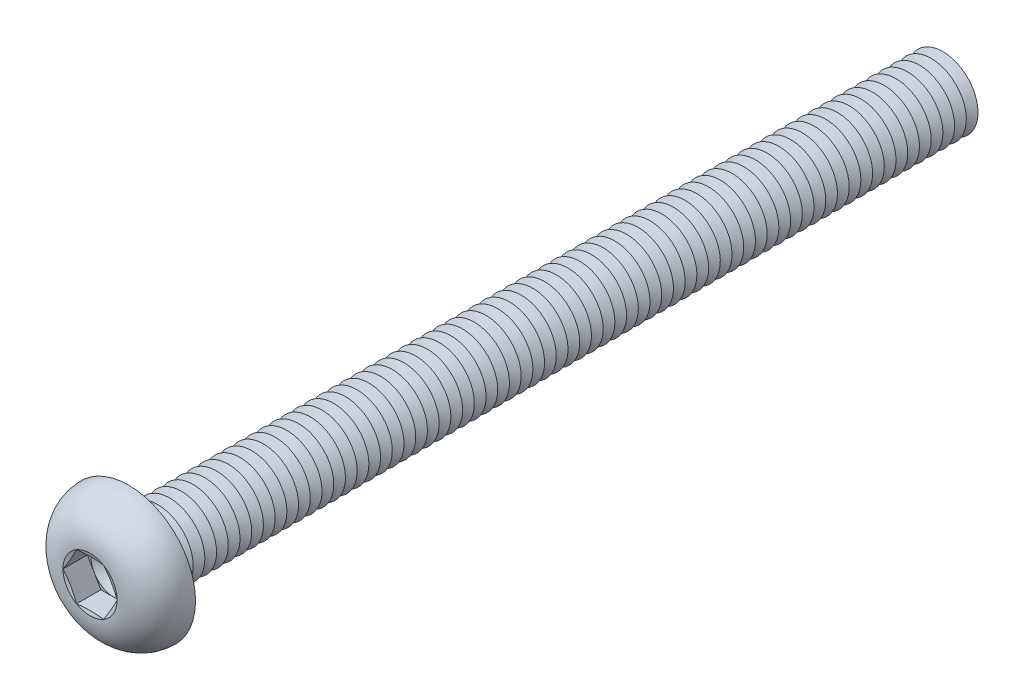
SolidWorks part; units mm, degrees
ref_plane "Front Plane" through (0, 0, 0) normal (0, 0, 1) x (1, 0, 0)
ref_plane "Top Plane" through (0, 0, 0) normal (0, 1, 0) x (1, 0, 0)
ref_plane "Right Plane" through (0, 0, 0) normal (1, 0, 0) x (0, 0, -1)
sketch "Sketch1" plane through (0, 0, 0) normal (1, 0, 0) x (0, 0, -1)
  line L0 (0, 1.5) -> (0, 2.85)
  line L3 (0, 1.5) -> (35, 1.5)
  line L4 (35, 1.5) -> (35, 0)
  line L5 (35, 0) -> (-1.65, 0) construction
  line L6 (-1.65, 0) -> (35, 0)
  line L7 (-1.65, 1.1547) -> (-1.65, 0.5773) construction
  line L8 (-1.65, 0.5773) -> (-1.65, 0)
  line L9 (-1.65, 1.1547) -> (-1.4953, 0.5773)
  line L10 (-1.4953, 0.5773) -> (-1.65, 0.5773)
  line L11 (35, 0) -> (22.7481, 0) construction
  line L12 (0, 2.85) -> (-1.65, 2.85) construction
  arc A1 (0, 2.85) -> (-1.65, 1.1547) centre (0, 1.1994) ccw
  point P8 (35, 0.75)
  dimension "D1" = 5.7
  dimension "D2" = 3
  dimension "D3" = 1.65
  dimension "D4" = 2.3094
  dimension "D5" = 35
  dimension "D6" = 15
revolve "Revolve1" add sketch "Sketch1" angle 360 about L5
fillet "Fillet1" radius 0.25 1 edges at (0, 1.5, 0)
sketch "Sketch2" plane through (0, 0, 0) normal (1, 0, 0) x (0, 0, -1)
  line L0 (34.75, 1.5) -> (35.25, 1.5)
  line L1 (35, 1.5) -> (0.25, 1.5) construction
  line L2 (35.25, 1.5) -> (35, 1.067)
  line L3 (35, -1.5) -> (35, 1.5) construction
  line L4 (35, 1.067) -> (34.75, 1.5)
  dimension "D1" = 0.5
revolve "Cut-Revolve1" cut sketch "Sketch2" angle 360 about axis through (0, 0, -35) along (0, 0, -1)
pattern_linear "LPattern1" count 70 spacing 0.5 along (0, 0, 1) of "Cut-Revolve1"
sketch "Sketch3" plane through (0, 0, 1.65) normal (0, 0, 1) x (1, 0, 0)
  line L7 (0.5773, 1) -> (-0.5774, 1)
  line L8 (-0.5774, 1) -> (-1.1547, 0)
  line L9 (-1.1547, 0) -> (-0.5773, -1)
  line L10 (-0.5773, -1) -> (0.5773, -1)
  line L11 (0.5773, -1) -> (1.1547, 0)
  line L12 (1.1547, 0) -> (0.5773, 1)
  circle A0 centre (0, 0) radius 1 construction
  circle A3 centre (0, 0) radius 1.1547 construction
extrude "Cut-Extrude1" cut sketch "Sketch3" against normal blind 1.04
sketch "Sketch4" plane through (0, 0, 0.61) normal (0, 0, 1) x (1, 0, 0)
  line L1 (0.5773, 1) -> (-0.5774, 1) construction
  circle A0 centre (0, 0) radius 1
extrude "Cut-Extrude2" cut sketch "Sketch4" against normal through all draft 60
